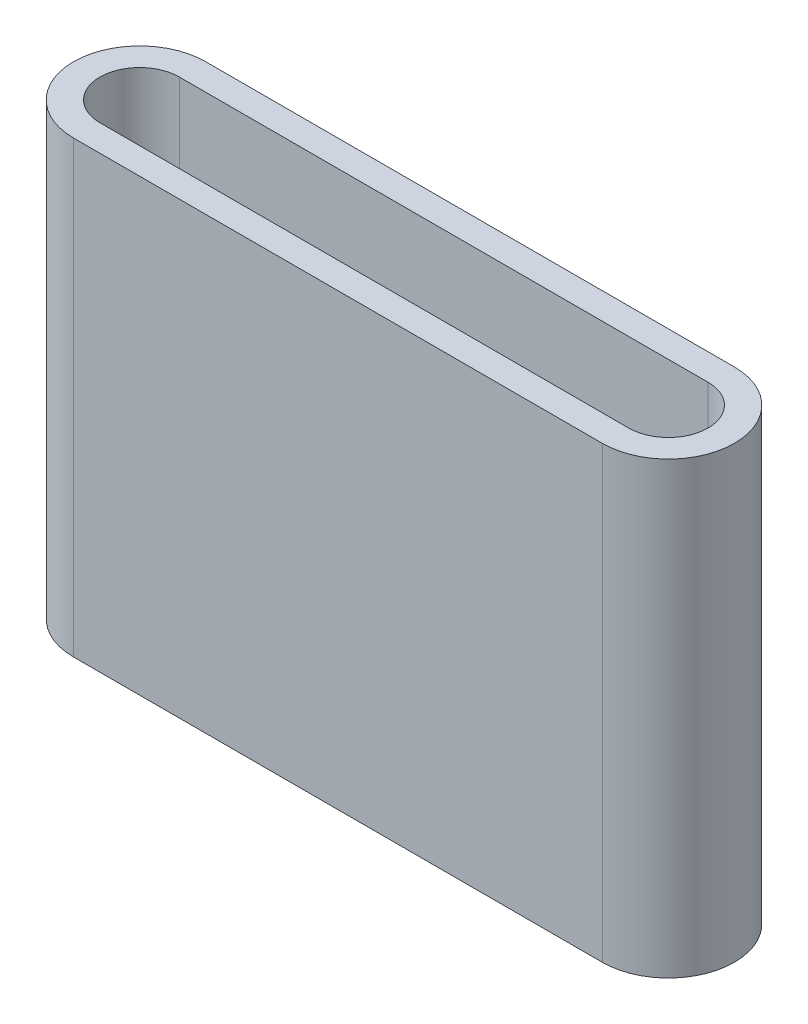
SolidWorks part; units mm, degrees
ref_plane "前视基准面" through (0, 0, 0) normal (0, 0, 1) x (1, 0, 0)
ref_plane "上视基准面" through (0, 0, 0) normal (0, 1, 0) x (1, 0, 0)
ref_plane "右视基准面" through (0, 0, 0) normal (1, 0, 0) x (0, 0, -1)
sketch "草图1" plane through (0, 0, 0) normal (0, 1, 0) x (1, 0, 0)
  line L0 (0, 0) -> (100, 0) construction
  line L1 (0, 12.5) -> (100, 12.5)
  line L2 (0, -12.5) -> (100, -12.5)
  arc A0 (0, 12.5) -> (0, -12.5) centre (0, 0) ccw
  arc A1 (100, -12.5) -> (100, 12.5) centre (100, 0) ccw
  point P3 (50, 0)
  dimension "D1" = 100
  dimension "D2" = 25
extrude "凸台-拉伸1" add sketch "草图1" along normal blind 20 and the other way blind 10
sketch "草图2" plane through (0, 20, 0) normal (0, 1, 0) x (1, 0, 0)
  line L2 (0, -12.5) -> (100, -12.5)
  line L3 (100, 12.5) -> (0, 12.5)
  line L4 (0, -12.5) -> (100, -12.5)
  line L5 (100, 12.5) -> (0, 12.5)
  arc A2 (0, 12.5) -> (0, -12.5) centre (0, 0) ccw
  arc A3 (100, -12.5) -> (100, 12.5) centre (100, 0) ccw
  arc A4 (0, 12.5) -> (0, -12.5) centre (0, 0) ccw
  arc A5 (100, -12.5) -> (100, 12.5) centre (100, 0) ccw
  dimension "D1" = 0
extrude "拉伸-薄壁1" add sketch "草图2" along normal blind 55 thin
